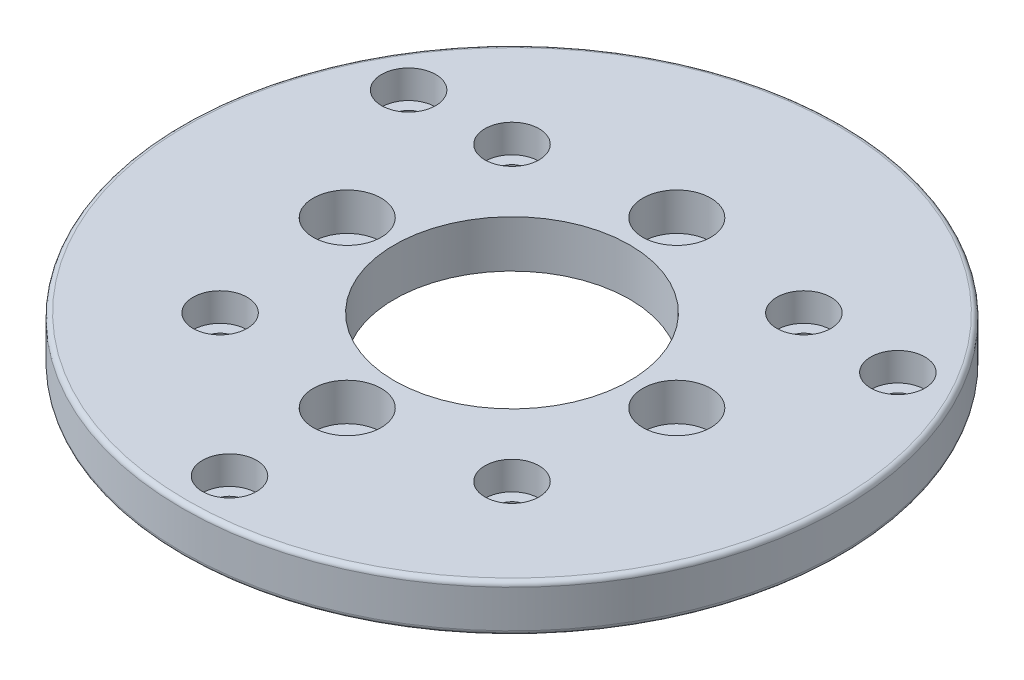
SolidWorks part; units mm, degrees
ref_plane "Alzado" through (0, 0, 0) normal (0, 0, 1) x (1, 0, 0)
ref_plane "Planta" through (0, 0, 0) normal (0, 1, 0) x (1, 0, 0)
ref_plane "Vista lateral" through (0, 0, 0) normal (1, 0, 0) x (0, 0, -1)
sketch "Croquis1" plane through (0, 0, 0) normal (0, 1, 0) x (1, 0, 0)
  line L0 (-25.9808, 15) -> (0, -30) construction
  line L1 (0, -30) -> (25.9808, 15) construction
  line L2 (25.9808, 15) -> (-25.9808, 15) construction
  line L3 (0, 27) -> (0, 0) construction
  line L4 (-15, -15) -> (15, -15) construction
  line L5 (-15, -15) -> (-15, 15) construction
  line L6 (-15, 15) -> (15, 15) construction
  line L7 (15, -15) -> (15, 15) construction
  line L8 (-15, -15) -> (15, 15) construction
  line L9 (-15, 15) -> (15, -15) construction
  line L27 (0, -25) -> (0, 0) construction
  line L30 (-15.5, 15.5) -> (15.5, 15.5) construction
  line L31 (-15.5, 15.5) -> (-15.5, -15.5) construction
  line L32 (-15.5, -15.5) -> (15.5, -15.5) construction
  line L33 (15.5, 15.5) -> (15.5, -15.5) construction
  line L34 (-15.5, 15.5) -> (15.5, -15.5) construction
  line L35 (-15.5, -15.5) -> (15.5, 15.5) construction
  circle A0 centre (0, 0) radius 35
  circle A1 centre (0, 0) radius 30 construction
  circle A2 centre (-25.9808, 15) radius 1.6
  circle A3 centre (25.9808, 15) radius 1.6
  circle A4 centre (0, -30) radius 1.6
  circle A5 centre (0, 0) radius 12.5
  circle A6 centre (-15.5, 15.5) radius 1.6
  circle A7 centre (15.5, 15.5) radius 1.6
  circle A8 centre (15.5, -15.5) radius 1.6
  circle A9 centre (-15.5, -15.5) radius 1.6
  circle A10 centre (0, 0) radius 17.5 construction
  circle A11 centre (17.5, 0) radius 2.05
  circle A12 centre (0, 17.5) radius 2.05
  circle A13 centre (-17.5, 0) radius 2.05
  circle A14 centre (0, -17.5) radius 2.05
  dimension "D1" = 70
  dimension "D2" = 60
  dimension "D3" = 3.2
  dimension "D4" = 25
  dimension "D6" = 35
  dimension "D7" = 4.1
  dimension "D5" = 30
  dimension "D9" = 31
extrude "Saliente-Extruir1" add sketch "Croquis1" along normal blind 5
fillet "Redondeo1" radius 0.5 2 edges at (0, 0, 35) (0, 5, 35)
sketch "Croquis2" plane through (0, 5, 0) normal (0, 1, 0) x (1, 0, 0)
  circle A0 centre (-25.9808, 15) radius 2.875
  circle A1 centre (25.9808, 15) radius 2.875
  circle A2 centre (0, -30) radius 2.875
  circle A3 centre (-15.5, 15.5) radius 2.875
  circle A4 centre (15.5, 15.5) radius 2.875
  circle A5 centre (15.5, -15.5) radius 2.875
  circle A6 centre (-15.5, -15.5) radius 2.875
  dimension "D1" = 5.75
extrude "Cortar-Extruir1" cut sketch "Croquis2" against normal blind 3
sketch "Croquis3" plane through (0, 5, 0) normal (0, 1, 0) x (1, 0, 0)
  circle A0 centre (0, 17.5) radius 3.61
  circle A1 centre (17.5, 0) radius 3.61
  circle A2 centre (0, -17.5) radius 3.61
  circle A3 centre (-17.5, 0) radius 3.61
  dimension "D1" = 7.22
extrude "Cortar-Extruir2" cut sketch "Croquis3" against normal blind 4
